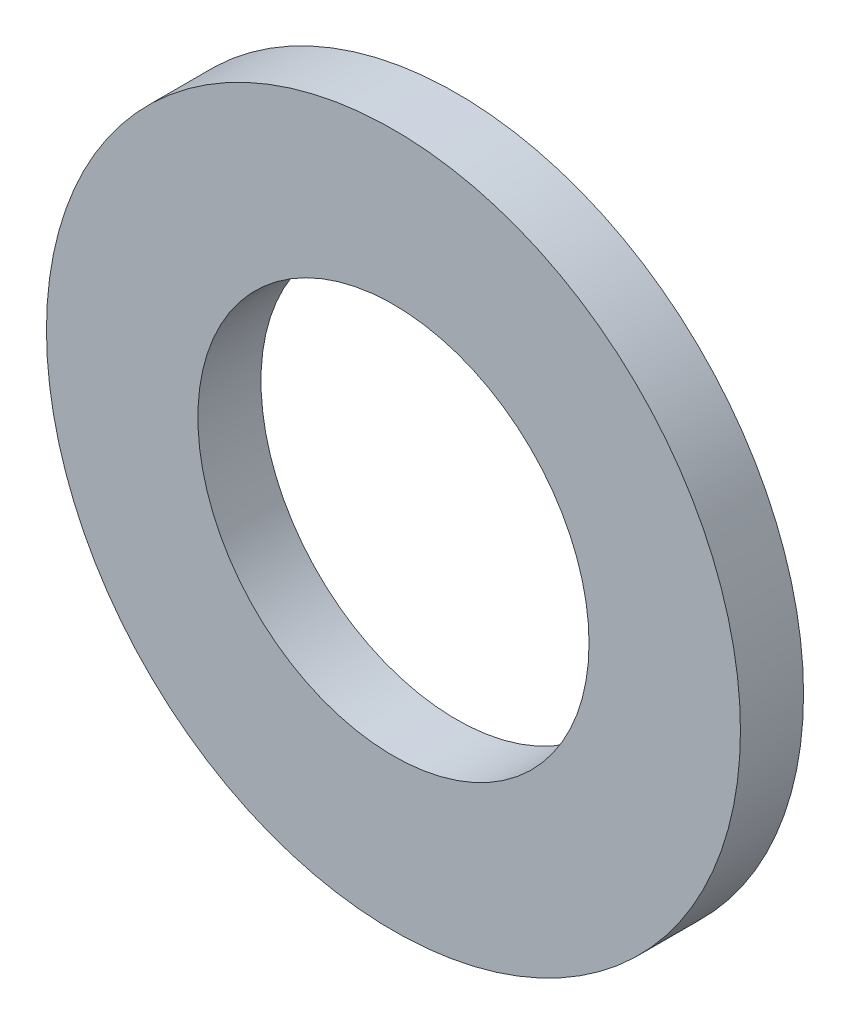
SolidWorks part; units mm, degrees
ref_plane "Plan de face" through (0, 0, 0) normal (0, 0, 1) x (1, 0, 0)
ref_plane "Plan de dessus" through (0, 0, 0) normal (0, 1, 0) x (1, 0, 0)
ref_plane "Plan de droite" through (0, 0, 0) normal (1, 0, 0) x (0, 0, -1)
sketch "Esquisse1" plane through (0, 0, 0) normal (0, 0, 1) x (1, 0, 0)
  circle A0 centre (0, 0) radius 27.5
  circle A1 centre (0, 0) radius 15.5
  dimension "D1" = 55
  dimension "D2" = 31
extrude "Extrusion1" add sketch "Esquisse1" along normal blind 5
